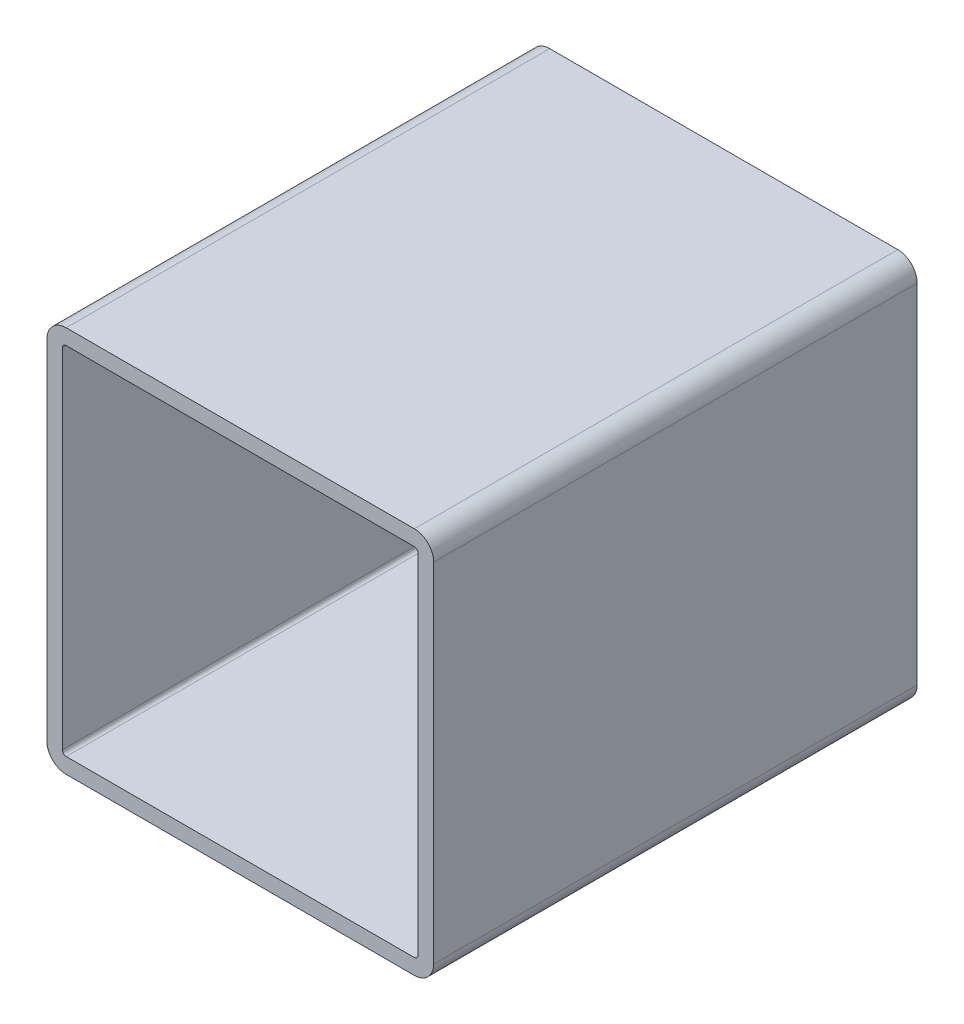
SolidWorks part; units mm, degrees
ref_plane "Face" through (0, 0, 0) normal (0, 0, 1) x (1, 0, 0)
ref_plane "Dessus" through (0, 0, 0) normal (0, 1, 0) x (1, 0, 0)
ref_plane "Droite" through (0, 0, 0) normal (1, 0, 0) x (0, 0, -1)
sketch "Esquisse1" plane through (0, 0, 0) normal (0, 0, 1) x (1, 0, 0)
  line L0 (5, -4) -> (95, -4)
  line L1 (5, 0) -> (95, 0)
  line L2 (0, -5) -> (0, -95)
  line L3 (5, -100) -> (95, -100)
  line L4 (100, -5) -> (100, -95)
  line L5 (96, -5) -> (96, -95)
  line L6 (5, -96) -> (95, -96)
  line L7 (4, -5) -> (4, -95)
  arc A0 (100, -5) -> (95, 0) centre (95, -5) ccw
  arc A1 (100, -95) -> (95, -100) centre (95, -95) cw
  arc A2 (0, -95) -> (5, -100) centre (5, -95) ccw
  arc A3 (5, 0) -> (0, -5) centre (5, -5) ccw
  arc A4 (96, -5) -> (95, -4) centre (95, -5) ccw
  arc A5 (96, -95) -> (95, -96) centre (95, -95) cw
  arc A6 (4, -95) -> (5, -96) centre (5, -95) ccw
  arc A7 (5, -4) -> (4, -5) centre (5, -5) ccw
  point P7 (100, 0)
  point P12 (0, -100)
  point P15 (0, 0)
  dimension "D3" = 5
  dimension "D1" = 100
  dimension "D2" = 100
  dimension "D4" = 4
extrude "Base-Extrusion" add sketch "Esquisse1" along normal blind 125
